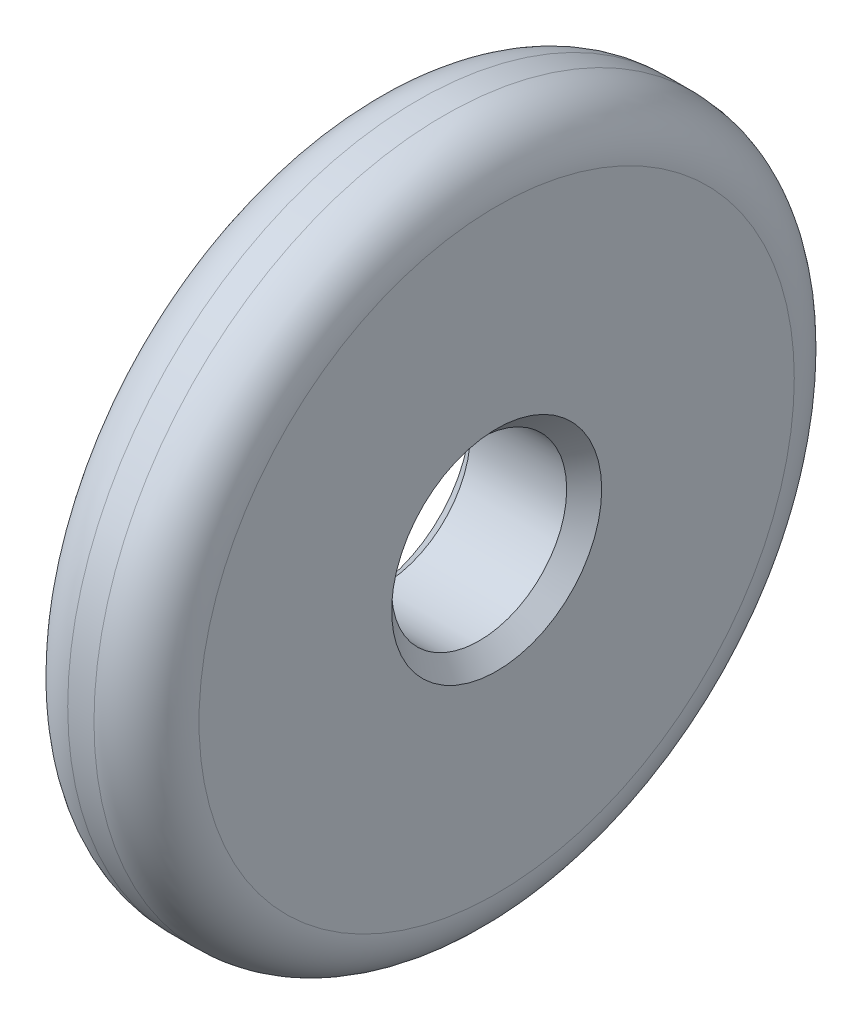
SolidWorks part; units mm, degrees
ref_plane "Front Plane" through (0, 0, 0) normal (0, 0, 1) x (1, 0, 0)
ref_plane "Top Plane" through (0, 0, 0) normal (0, 1, 0) x (1, 0, 0)
ref_plane "Right Plane" through (0, 0, 0) normal (1, 0, 0) x (0, 0, -1)
sketch "Sketch1" plane through (0, 0, 0) normal (1, 0, 0) x (0, 0, -1)
  circle A0 centre (0, 0) radius 20
  dimension "D1" = 40
extrude "Boss-Extrude1" add sketch "Sketch1" along normal mid plane 7.5
sketch "Sketch2" plane through (3.75, 0, 0) normal (1, 0, 0) x (0, 0, -1)
  circle A0 centre (0, 0) radius 5
  dimension "D1" = 10
extrude "Cut-Extrude1" cut sketch "Sketch2" against normal through all contours A0
chamfer "Chamfer1" distance 1 angle 45 2 edges at (-3.75, 0, -5) (3.75, 0, -5)
fillet "Fillet1" radius 3 2 edges at (-3.75, 0, -20) (3.75, 0, -20)
